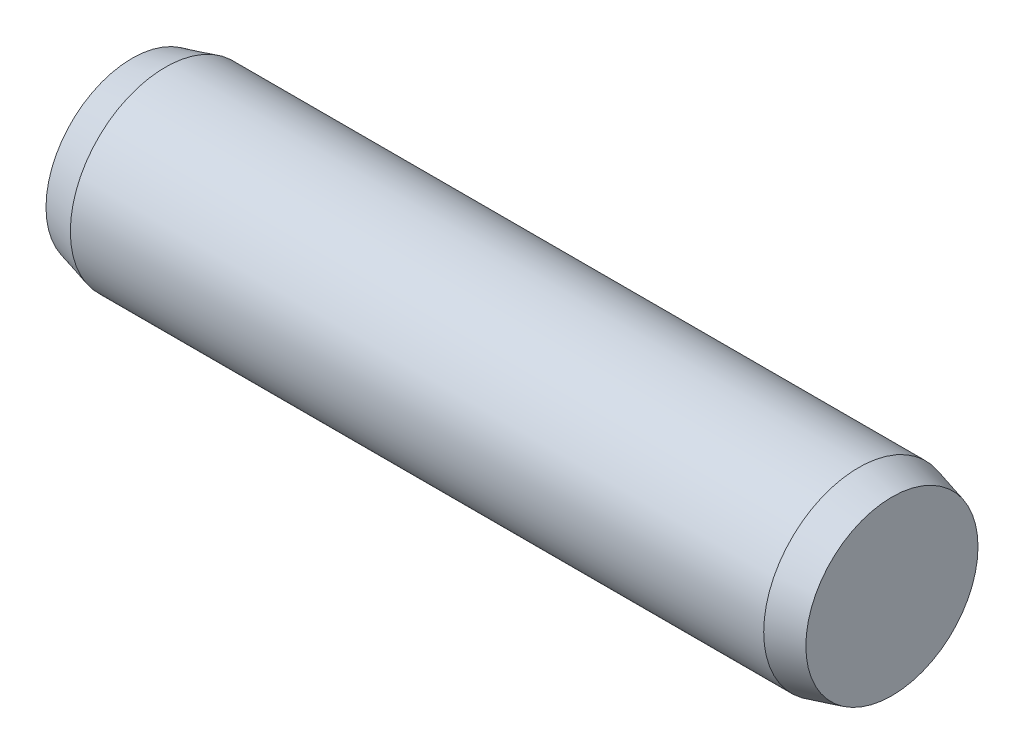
SolidWorks part; units mm, degrees
ref_plane "Plane1" through (0, 0, 0) normal (0, 0, 1) x (1, 0, 0)
ref_plane "Plane2" through (0, 0, 0) normal (0, 1, 0) x (1, 0, 0)
ref_plane "Plane3" through (0, 0, 0) normal (1, 0, 0) x (0, 0, -1)
sketch "Sketch1" plane through (0, 0, 0) normal (0, 0, 1) x (1, 0, 0)
  line L1 (-6.35, 0) -> (107.95, 0) construction
  line L2 (-4, 0) -> (4, 0)
  line L3 (4, 0) -> (4, 0.9062)
  line L4 (4, 0.9062) -> (3.65, 1)
  line L5 (3.65, 1) -> (-3.65, 1)
  line L6 (-4, 0.9062) -> (-4, 0)
  line L7 (-4, 0.9062) -> (-3.65, 1)
revolve "Base-Revolve" add sketch "Sketch1" angle 360 about L1
equation "\"D3@Sketch1\" = 15.0"
equation "\"D1@Sketch1\" = \"Chamfer_len@Sketch1\""
equation "\"D2@Sketch1\" = \"D3@Sketch1\""
equation "\"D4@Sketch1\"=\"Length@Sketch1\"/2"
